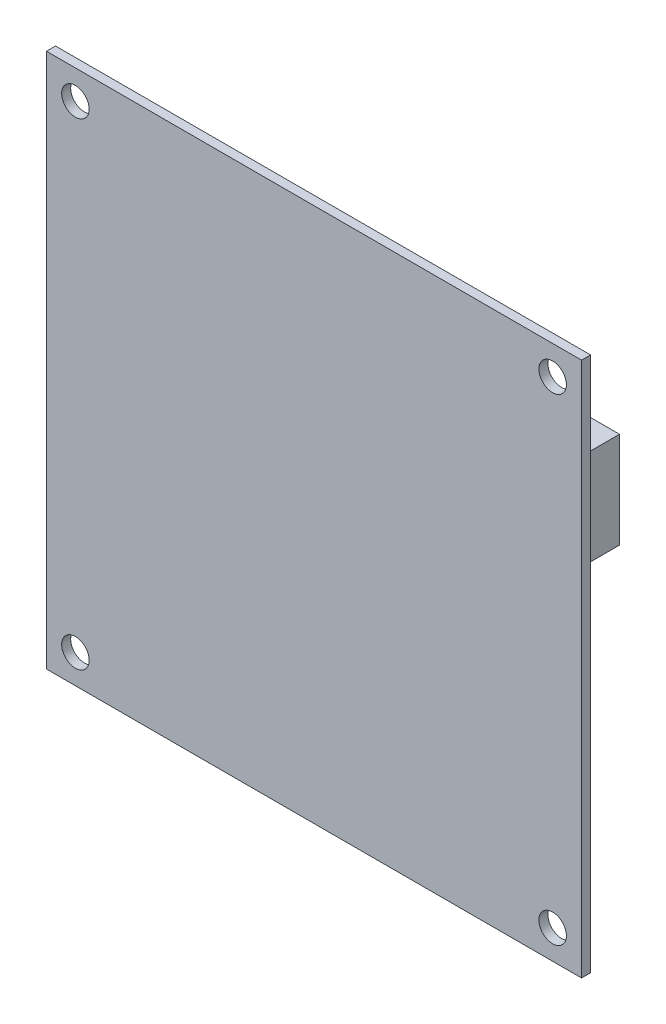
SolidWorks part; units mm, degrees
ref_plane "Front Plane" through (0, 0, 0) normal (0, 0, 1) x (1, 0, 0)
ref_plane "Top Plane" through (0, 0, 0) normal (0, 1, 0) x (1, 0, 0)
ref_plane "Right Plane" through (0, 0, 0) normal (1, 0, 0) x (0, 0, -1)
sketch "Sketch1" plane through (0, 0, 0) normal (0, 0, 1) x (1, 0, 0)
  line L1 (-46.99, -46.99) -> (46.99, -46.99)
  line L2 (-46.99, -46.99) -> (-46.99, 46.99)
  line L3 (-46.99, 46.99) -> (46.99, 46.99)
  line L4 (46.99, -46.99) -> (46.99, 46.99)
  line L5 (-46.99, -46.99) -> (46.99, 46.99) construction
  line L6 (-46.99, 46.99) -> (46.99, -46.99) construction
  line L7 (41.91, -41.91) -> (-41.91, -41.91) construction
  line L8 (41.91, -41.91) -> (41.91, 41.91) construction
  line L9 (41.91, 41.91) -> (-41.91, 41.91) construction
  line L10 (-41.91, -41.91) -> (-41.91, 41.91) construction
  line L11 (41.91, -41.91) -> (-41.91, 41.91) construction
  line L12 (41.91, 41.91) -> (-41.91, -41.91) construction
  circle A0 centre (-41.91, 41.91) radius 2.413
  circle A1 centre (41.91, 41.91) radius 2.413
  circle A2 centre (41.91, -41.91) radius 2.413
  circle A3 centre (-41.91, -41.91) radius 2.413
  point P0 (0, 0)
  point P6 (0, 0)
  dimension "D3" = 4.826
  dimension "D1" = 93.98
  dimension "D2" = 93.98
  dimension "D4" = 83.82
  dimension "D5" = 83.82
extrude "Boss-Extrude1" add sketch "Sketch1" along normal blind 1.5875
sketch "Sketch2" plane through (0, 0, 0) normal (0, 0, -1) x (-1, 0, 0)
  line L0 (28.6892, -39.6603) -> (-30.2393, -39.6603) construction
  text T0 "LTC2156A Energy Monitor"
extrude "Cut-Extrude1" cut sketch "Sketch2" against normal blind 0.127
sketch "Sketch3" plane through (0, 0, 0) normal (0, 0, -1) x (-1, 0, 0)
  line L0 (-46.99, -46.99) -> (-46.99, 46.99) construction
  line L1 (-45.72, 31.115) -> (-39.1922, 31.115)
  line L2 (-45.72, 31.115) -> (-45.72, 14.2494)
  line L3 (-45.72, 14.2494) -> (-39.1922, 14.2494)
  line L4 (-39.1922, 31.115) -> (-39.1922, 14.2494)
  line L5 (-46.99, 46.99) -> (46.99, 46.99) construction
  dimension "D1" = 6.5278
  dimension "D2" = 16.8656
  dimension "D3" = 1.27
  dimension "D4" = 15.875
extrude "Boss-Extrude2" add sketch "Sketch3" along normal blind 6.35
